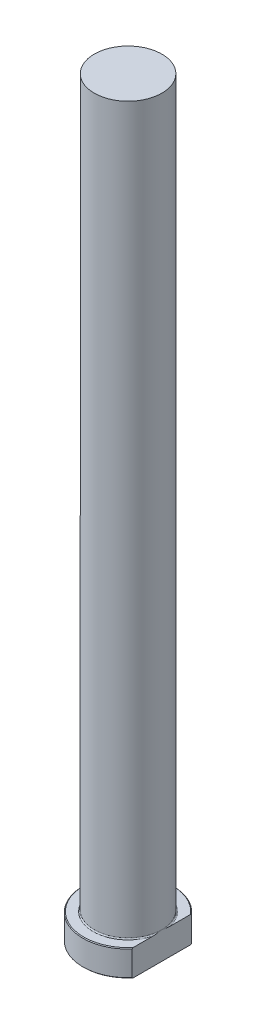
SolidWorks part; units mm, degrees
ref_plane "Front Plane" through (0, 0, 0) normal (0, 0, 1) x (1, 0, 0)
ref_plane "Top Plane" through (0, 0, 0) normal (0, 1, 0) x (1, 0, 0)
ref_plane "Right Plane" through (0, 0, 0) normal (1, 0, 0) x (0, 0, -1)
sketch "Sketch1" plane through (0, 0, 0) normal (0, 0, 1) x (1, 0, 0)
  line L0 (0, 259.9588) -> (0, -15.1925) construction
  line L1 (0, 0) -> (-12, 0)
  line L2 (-12, 0) -> (-12, 7)
  line L3 (-12, 7) -> (-9, 7)
  line L4 (-9, 7) -> (-9, 200)
  line L5 (-9, 200) -> (0, 200)
  line L6 (0, 200) -> (0, 0)
  dimension "L" = 200
  dimension "H" = 24
  dimension "T" = 7
  dimension "D" = 18
revolve "Revolve1" add sketch "Sketch1" angle 360 about L0
chamfer "Chamfer1" distance 0.2 angle 45 2 edges at (0, 7, 12) (0, 0, 12)
fillet "Fillet1" radius 0.3 1 edges at (0, 7, 9)
sketch "Sketch2" plane through (0, 0, 0) normal (0, 1, 0) x (1, 0, 0)
  line L0 (9, 7.9373) -> (9, -7.9373)
  circle A0 centre (0, 0) radius 12 construction
  arc A1 (9, -7.9373) -> (9, 7.9373) centre (0, 0) ccw
  circle A2 centre (0, 0) radius 9 construction
extrude "KEY" cut sketch "Sketch2" along normal through all
